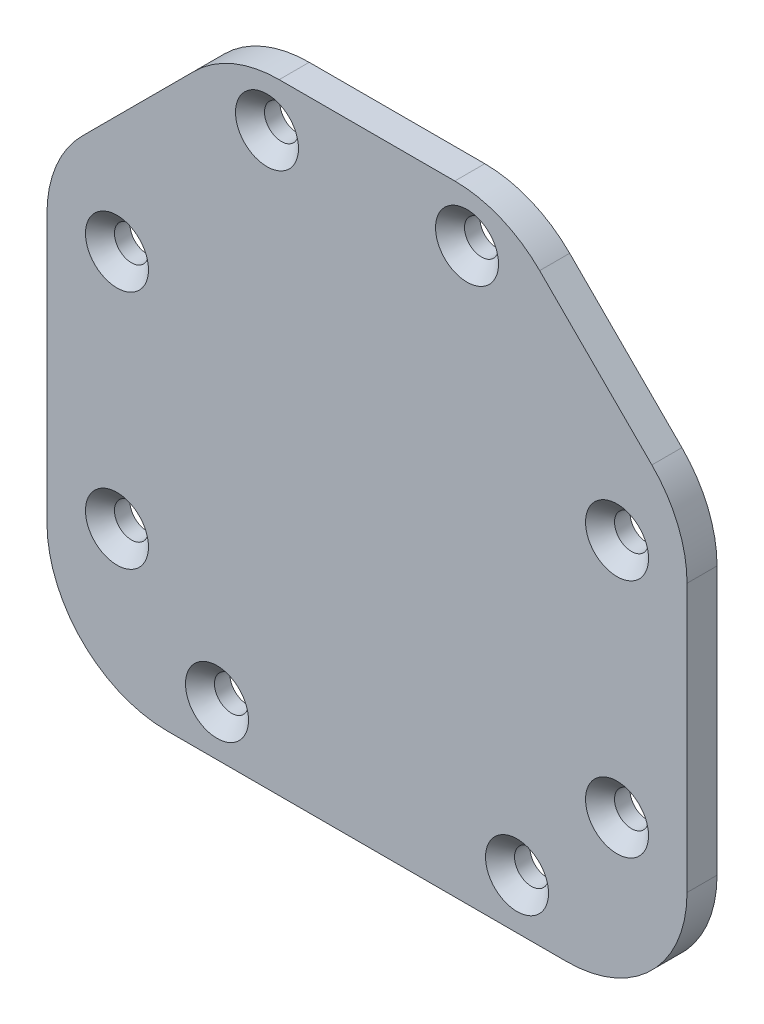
SolidWorks part; units mm, degrees
ref_plane "Face" through (0, 0, 0) normal (0, 0, 1) x (1, 0, 0)
ref_plane "Dessus" through (0, 0, 0) normal (0, 1, 0) x (1, 0, 0)
ref_plane "Droite" through (0, 0, 0) normal (1, 0, 0) x (0, 0, -1)
sketch "Esquisse1" plane through (0, 0, 0) normal (0, 0, 1) x (1, 0, 0)
  line L0 (-32, 9.7794) -> (-32, -17)
  line L1 (-20, -29) -> (20, -29)
  line L2 (32, -17) -> (32, 9.7794)
  line L3 (28.4853, 18.2647) -> (17.2647, 29.4853)
  line L4 (8.7794, 33) -> (-8.7794, 33)
  line L5 (-17.2647, 29.4853) -> (-28.4853, 18.2647)
  arc A0 (32, 9.7794) -> (28.4853, 18.2647) centre (20, 9.7794) ccw
  arc A1 (17.2647, 29.4853) -> (8.7794, 33) centre (8.7794, 21) ccw
  arc A2 (-8.7794, 33) -> (-17.2647, 29.4853) centre (-8.7794, 21) ccw
  arc A3 (-32, 9.7794) -> (-28.4853, 18.2647) centre (-20, 9.7794) cw
  arc A4 (-32, -17) -> (-20, -29) centre (-20, -17) ccw
  arc A5 (20, -29) -> (32, -17) centre (20, -17) ccw
  point P11 (13.75, 33)
  point P15 (-13.75, 33)
  point P18 (-32, 14.75)
  point P21 (-32, -29)
  point P24 (32, -29)
  dimension "D7" = 27.5
  dimension "D9" = 12
  dimension "D1" = 32
  dimension "D2" = 64
  dimension "D3" = 62
  dimension "D4" = 29
  dimension "D5" = 135
  dimension "D6" = 135
  dimension "D8" = 18.25
extrude "Base-Extrusion" add sketch "Esquisse1" along normal blind 3
hole_wizard "Fraisage pour vis à tête fraisée M31" positions "Esquisse7" profile "Esquisse6" countersink size "M3" standard "Ansi Métrique"
sketch "Esquisse7" plane through (0, 0, 3) normal (0, 0, 1) x (1, 0, 0)
  circle A0 centre (0, 0) radius 25.5 construction
  point P0 (10, 28)
  point P1 (-10, 28)
  point P2 (-25, 10)
  point P3 (-25, -14)
  point P4 (-15, -24)
  point P5 (15, -24)
  point P6 (25, -14)
  point P7 (25, 10)
  dimension "D1" = 10
  dimension "D2" = 20
  dimension "D3" = 28
  dimension "D4" = 25
  dimension "D5" = 10
  dimension "D6" = 50
  dimension "D7" = 14
  dimension "D8" = 24
  dimension "D9" = 15
  dimension "D10" = 30
sketch "Esquisse6" plane through (10, 28, 3) normal (1, 0, 0) x (0, -1, 0)
  line L0 (0, 0) -> (0, 3)
  line L1 (0, 3) -> (1.7, 3)
  line L2 (1.7, 3) -> (1.7, 1.45)
  line L3 (1.7, 1.45) -> (3.15, 0)
  line L5 (3.15, 0) -> (0, 0)
  line L6 (-1.7, 1.45) -> (-3.15, 0) construction
  line L11 (0, -6.35) -> (0, 107.95) construction
  dimension "Diamètre du perçage jusqu'au prochain" = 3.4
  dimension "Profondeur du perçage jusqu'au prochain" = 3
  dimension "Diamètre du fraisage entrant" = 6.3
  dimension "Angle du fraisage entrant" = 90
